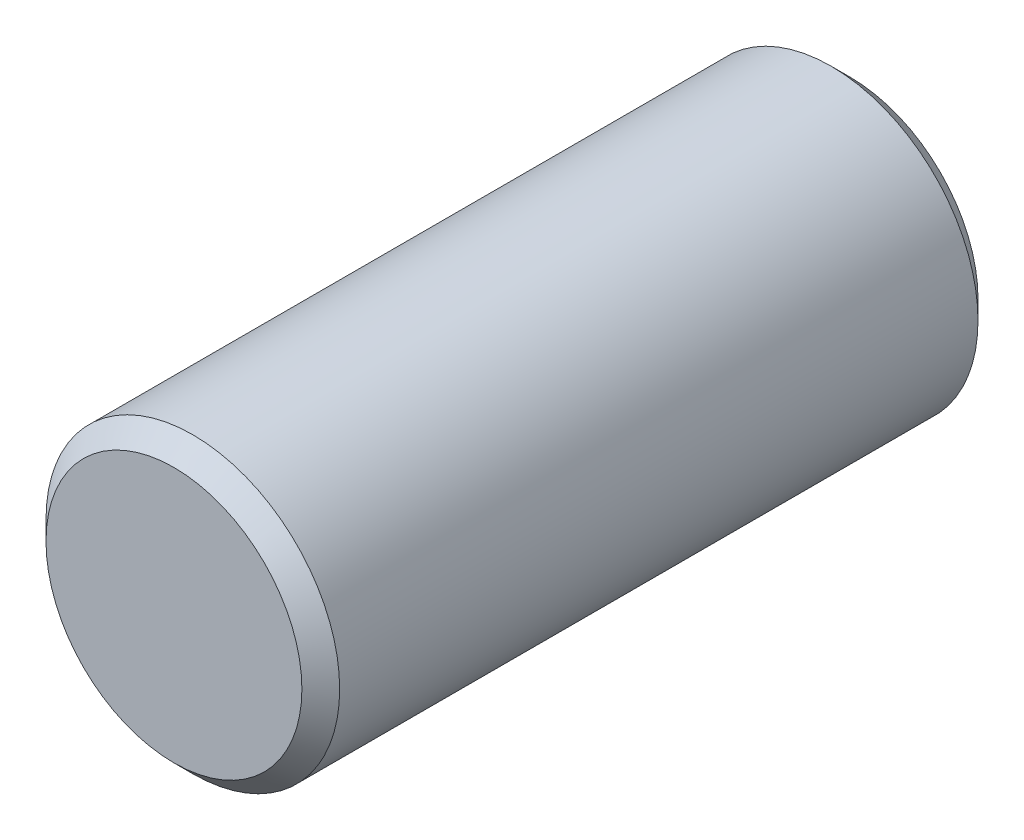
SolidWorks part; units mm, degrees
ref_plane "Frontale" through (0, 0, 0) normal (0, 0, 1) x (1, 0, 0)
ref_plane "Superiore" through (0, 0, 0) normal (0, 1, 0) x (1, 0, 0)
ref_plane "Destro" through (0, 0, 0) normal (1, 0, 0) x (0, 0, -1)
sketch "Sketch1" plane through (0, 0, 0) normal (0, 0, 1) x (1, 0, 0)
  circle A0 centre (0, 0) radius 1.9748
  dimension "D1" = 3.9497
extrude "Extrude1" add sketch "Sketch1" along normal mid plane 9.0932
chamfer "Chamfer1" distance 0.254 angle 45 2 edges at (1.9748, 0, -4.5466) (1.9748, 0, 4.5466)
